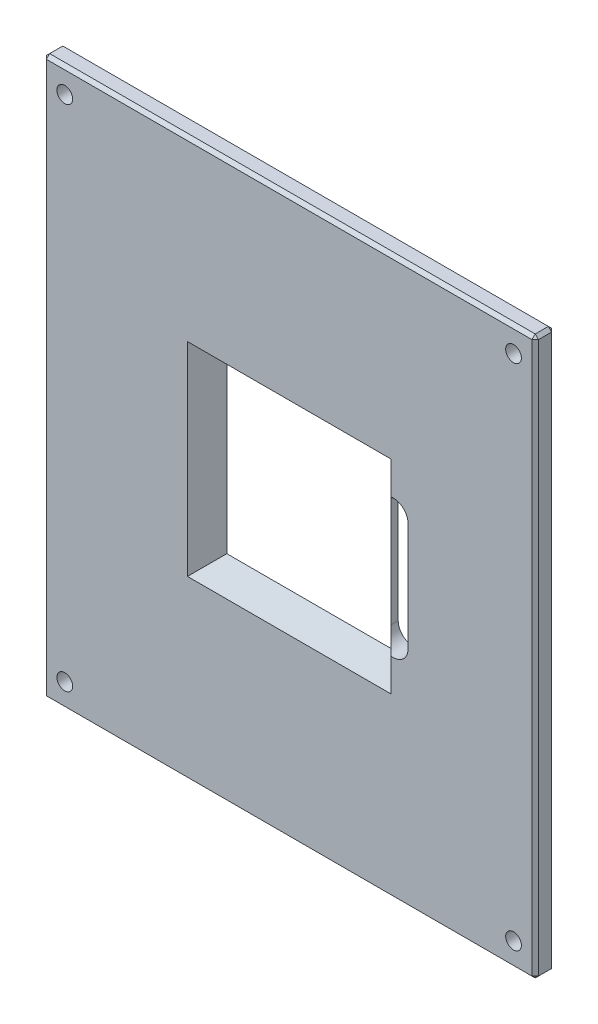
SolidWorks part; units mm, degrees
ref_plane "Front Plane" through (0, 0, 0) normal (0, 0, 1) x (1, 0, 0)
ref_plane "Top Plane" through (0, 0, 0) normal (0, 1, 0) x (1, 0, 0)
ref_plane "Right Plane" through (0, 0, 0) normal (1, 0, 0) x (0, 0, -1)
sketch "Sketch1" plane through (0, 0, 0) normal (0, 0, 1) x (1, 0, 0)
  line L0 (37.5, -42.5) -> (-37.5, 42.5) construction
  line L1 (37.5, 42.5) -> (-37.5, -42.5) construction
  line L2 (12.5, 12.5) -> (12.5, -12.5) construction
  line L3 (12.5, -12.5) -> (-12.5, -12.5) construction
  line L12 (-12.5, -12.5) -> (-12.5, 12.5) construction
  line L13 (-12.5, 12.5) -> (12.5, 12.5) construction
  line L14 (12.5, 12.5) -> (12.5, -12.5)
  line L15 (12.5, -12.5) -> (-12.5, -12.5)
  line L16 (-12.5, -12.5) -> (-12.5, 12.5)
  line L17 (-12.5, 12.5) -> (12.5, 12.5)
  line L22 (-37, 42.5) -> (37, 42.5) construction
  line L23 (-37.5, -42.5) -> (37.5, -42.5)
  line L24 (-37.5, -42.5) -> (-37.5, 42.5)
  line L25 (-37.5, 42.5) -> (37.5, 42.5)
  line L30 (37.5, -42.5) -> (37.5, 42.5)
  line L31 (-37.5, -42.5) -> (37.5, 42.5) construction
  line L32 (-37.5, 42.5) -> (37.5, -42.5) construction
  line L33 (37.5, 42) -> (37.5, -42) construction
  line L34 (37, -42.5) -> (-37, -42.5) construction
  point P2 (34.1919, 38.7508)
  point P4 (-34.1919, -38.7508)
  point P6 (34.1919, -38.7508)
  point P7 (-50.9245, 9.2668)
  point P15 (0, 0)
  point P60 (-34.1919, 38.7508)
extrude "Boss-Extrude1" add sketch "Sketch1" along normal blind 3
hole_wizard "M2 Clearance Hole1" positions "Sketch4" profile "Sketch5" hole size "M2" standard "ISO"
sketch "Sketch4" plane through (0, 0, 3) normal (0, 0, 1) x (1, 0, 0)
  point P0 (-34.1919, 38.7508)
  point P2 (34.1919, 38.7508)
  point P4 (-34.1919, -38.7508)
  point P6 (34.1919, -38.7508)
  point P9 (-16.0019, 22.9189)
  point P14 (-19.3338, 23.6302)
sketch "Sketch5" plane through (-34.1919, 38.7508, 3) normal (1, 0, 0) x (0, -1, 0)
  line L0 (0, 0) -> (0, 3)
  line L1 (0, 3) -> (1.2, 3)
  line L2 (1.2, 3) -> (1.2, 0)
  line L5 (1.2, 0) -> (0, 0)
  line L11 (0, -6.35) -> (0, 107.95) construction
  dimension "Thru Hole Dia." = 2.4
  dimension "Thru Hole Depth" = 3
sketch "Sketch6" plane through (0, 0, 3) normal (0, 0, 1) x (1, 0, 0)
  line L0 (-18.12, -18.195) -> (18.12, -18.195) construction
  line L1 (18.12, -18.195) -> (18.12, 18.195) construction
  line L2 (-18.12, 18.195) -> (18.12, 18.195) construction
  line L3 (-18.12, -18.195) -> (-18.12, 18.195) construction
  line L4 (-18.12, -18.195) -> (18.12, -18.195) construction
  line L5 (18.12, -18.195) -> (18.12, 18.195) construction
  line L6 (-18.12, 18.195) -> (18.12, 18.195) construction
  line L7 (-18.12, -18.195) -> (-18.12, 18.195) construction
  line L8 (15.87, 8.28) -> (15.87, -8.28) construction
  line L9 (18.12, 8.28) -> (18.12, -8.28)
  line L10 (13.62, 8.28) -> (13.62, -8.28)
  arc A0 (18.12, 8.28) -> (13.62, 8.28) centre (15.87, 8.28) ccw
  arc A1 (13.62, -8.28) -> (18.12, -8.28) centre (15.87, -8.28) ccw
  point P6 (15.87, 0)
  point P11 (0, 0)
  dimension "wires_slot_length" = 16.56
  dimension "wires_slot_width" = 4.5
extrude "Cut-Extrude1" cut sketch "Sketch6" against normal through all
chamfer "Chamfer2" distance 0.5 angle 45 12 edges at (37.5, -42.5, 1.5) (0, -42.5, 3) (-37.5, -42.5, 1.5) (-37.5, 0, 3) (-37.5, 42.5, 1.5) (0, 42.5, 3) (37.5, 0, 3) (37.5, 42.5, 1.5) (0, 42.5, 0) (-37.5, 0, 0) (0, -42.5, 0) (37.5, 0, 0)
chamfer "Chamfer3" distance 3 angle 45 4 edges at (-12.5, 0, 3) (0, -12.5, 3) (12.5, 0, 3) (0, 12.5, 3)
